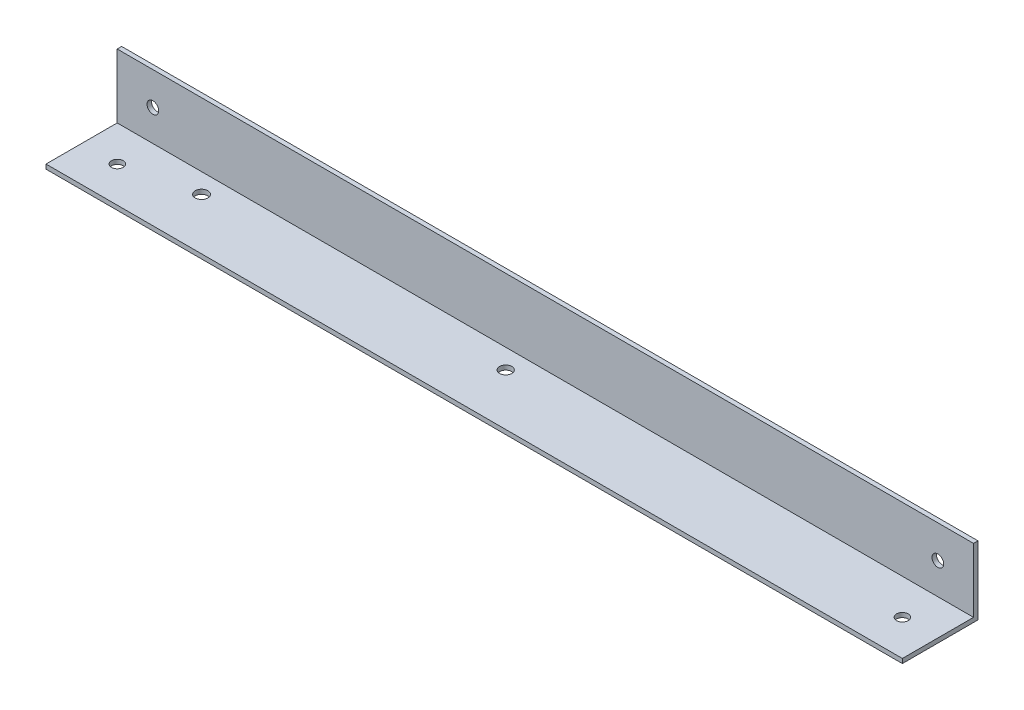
SolidWorks part; units mm, degrees
ref_plane "Front" through (0, 0, 0) normal (0, 0, 1) x (1, 0, 0)
ref_plane "Top" through (0, 0, 0) normal (0, 1, 0) x (1, 0, 0)
ref_plane "Right" through (0, 0, 0) normal (1, 0, 0) x (0, 0, -1)
sketch "Sketch1" plane through (0, 0, 0) normal (0, 0, 1) x (1, 0, 0)
  line L1 (-209.8261, 67.8385) -> (94.9739, 67.8385)
  line L2 (-209.8261, 67.8385) -> (-209.8261, 43.4545)
  line L3 (-209.8261, 43.4545) -> (94.9739, 43.4545)
  line L4 (94.9739, 67.8385) -> (94.9739, 43.4545)
  dimension "D1" = 304.8
  dimension "D2" = 24.384
extrude "Boss-Extrude1" add sketch "Sketch1" along normal blind 26.924
sketch "Sketch2" plane through (0, 67.8385, 0) normal (0, 1, 0) x (1, 0, 0)
  line L0 (-209.8261, -26.924) -> (-209.8261, 0) construction
  line L1 (-209.8261, -1.5875) -> (94.9739, -1.5875)
  line L2 (-209.8261, -1.5875) -> (-209.8261, -26.924)
  line L3 (-209.8261, -26.924) -> (94.9739, -26.924)
  line L4 (94.9739, -1.5875) -> (94.9739, -26.924)
  line L5 (94.9739, 0) -> (-209.8261, 0) construction
  dimension "D1" = 1.5875
extrude "Cut-Extrude1" cut sketch "Sketch2" against normal blind 12.7
sketch "Sketch3" plane through (0, 0, 26.924) normal (0, 0, 1) x (1, 0, 0)
  line L0 (94.9739, 43.4545) -> (94.9739, 55.1385) construction
  line L1 (-209.8261, 55.1385) -> (94.9739, 55.1385)
  line L2 (-209.8261, 55.1385) -> (-209.8261, 45.042)
  line L3 (-209.8261, 45.042) -> (94.9739, 45.042)
  line L4 (94.9739, 55.1385) -> (94.9739, 45.042)
  line L5 (-209.8261, 43.4545) -> (94.9739, 43.4545) construction
  dimension "D1" = 1.5875
extrude "Cut-Extrude3" cut sketch "Sketch3" against normal up to surface (25.3365 mm away)
sketch "Sketch4" plane through (0, 0, 0) normal (0, 0, -1) x (-1, 0, 0)
  line L0 (-94.9739, 43.4545) -> (-94.9739, 67.8385) construction
  line L1 (209.8261, 43.4545) -> (-94.9739, 43.4545) construction
  line L2 (57.4261, 28.0211) -> (57.4261, 119.205) construction
  circle A0 centre (-82.2739, 56.1545) radius 2.0828
  circle A1 centre (197.1261, 56.1545) radius 2.0828
  dimension "D3" = 4.1656
  dimension "D1" = 12.7
  dimension "D2" = 12.7
extrude "Cut-Extrude4" cut sketch "Sketch4" against normal blind 2.54
sketch "Sketch5" plane through (0, 43.4545, 0) normal (0, -1, 0) x (1, 0, 0)
  line L0 (-57.4261, 38.6497) -> (-57.4261, -24.6724) construction
  line L1 (-209.8261, 26.924) -> (-209.8261, 0) construction
  line L2 (-209.8261, 26.924) -> (94.9739, 26.924) construction
  circle A0 centre (-197.1261, 14.224) radius 2.0828
  circle A1 centre (82.2739, 14.224) radius 2.0828
  dimension "D1" = 4.1656
  dimension "D2" = 12.7
  dimension "D3" = 12.7
extrude "Cut-Extrude5" cut sketch "Sketch5" against normal blind 2.54
sketch "Sketch6" plane through (0, 45.042, 0) normal (0, 1, 0) x (1, 0, 0)
  circle A0 centre (-64.534, -8.5875) radius 2.1661
  circle A1 centre (-172.8015, -8.5875) radius 2.25
extrude "Cut-Extrude6" cut sketch "Sketch6" against normal blind 2.54
equation "\".5n\"=1"
